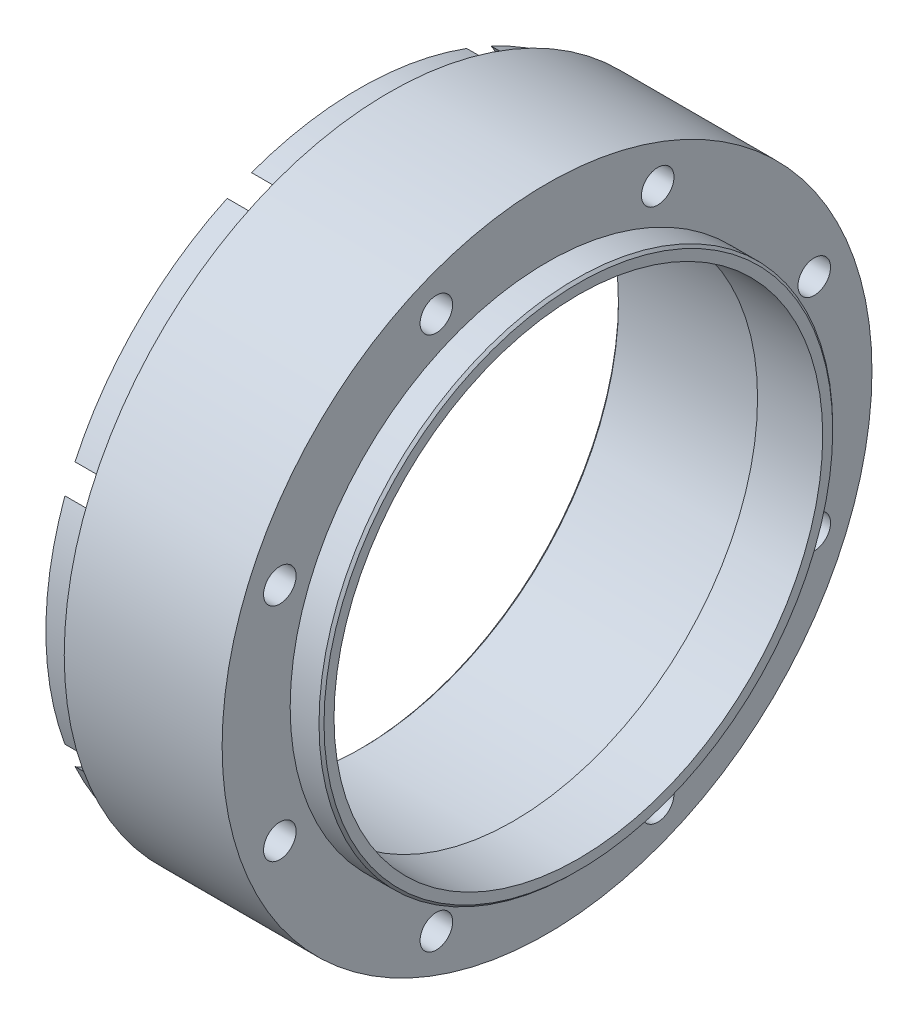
SolidWorks part; units mm, degrees
ref_plane "Front Plane" through (0, 0, 0) normal (0, 0, 1) x (1, 0, 0)
ref_plane "Top Plane" through (0, 0, 0) normal (0, 1, 0) x (1, 0, 0)
ref_plane "Right Plane" through (0, 0, 0) normal (1, 0, 0) x (0, 0, -1)
sketch "Sketch1" plane through (0, 0, 0) normal (1, 0, 0) x (0, 0, -1)
  circle A0 centre (0, 0) radius 65.8622
  dimension "D1" = 131.7244
extrude "Boss-Extrude1" add sketch "Sketch1" along normal blind 44.45
sketch "Sketch2" plane through (44.45, 0, 0) normal (1, 0, 0) x (0, 0, -1)
  circle A0 centre (0, 0) radius 49.53
  dimension "D1" = 99.06
extrude "Cut-Extrude1" cut sketch "Sketch2" against normal blind 152.4
sketch "Sketch7" plane through (0, 0, 0) normal (-1, 0, 0) x (0, 0, 1)
  circle A0 centre (0, 0) radius 63.4873
  dimension "D1" = 126.9746
extrude "Cut-Extrude4" cut sketch "Sketch7" against normal blind 6.096 flip side to cut
sketch "Sketch3" plane through (44.45, 0, 0) normal (1, 0, 0) x (0, 0, -1)
  circle A0 centre (0, 0) radius 52.07
  dimension "D1" = 104.14
extrude "Cut-Extrude2" cut sketch "Sketch3" against normal blind 6.35 flip side to cut
hole_wizard "Tapped Hole for #8-32 Helicoil1" positions "Sketch8" profile "Sketch9" tap size "#8-32" standard "Helicoil® Inch"
sketch "Sketch8" plane through (0, 0, 0) normal (-1, 0, 0) x (0, 0, 1)
  point P0 (0, 60.198)
  dimension "D1" = 60.198
sketch "Sketch9" plane through (0, 60.198, 0) normal (0, 1, 0) x (0, 0, 1)
  line L0 (0, 0) -> (0, 16.8396)
  line L1 (0, 16.8396) -> (2.1971, 15.5194)
  line L2 (2.1971, 15.5194) -> (2.1971, 0)
  line L5 (2.1971, 0) -> (0, 0)
  line L10 (0, 16.8396) -> (-2.1971, 15.5194) construction
  line L11 (0, -6.35) -> (0, 107.95) construction
  dimension "Tap Drill Dia." = 4.3942
  dimension "Tap Drill Depth" = 15.5194
  dimension "Drill Angle" = 118
pattern_circular "CirPattern2" count 8 over 360 about axis through (0, 0, 0) along (1, 0, 0) of "Tapped Hole for #8-32 Helicoil1"
hole_wizard "CBORE for M6 SHCS1" positions "Sketch10" profile "Sketch11" counterbore size "M6" standard "ANSI Metric"
sketch "Sketch10" plane through (0, 0, 0) normal (-1, 0, 0) x (0, 0, 1)
  line L0 (0, 0) -> (22.4348, 54.1624)
  line L2 (0, 0) -> (0, 60.198)
  point P0 (22.4348, 54.1624)
  dimension "D1" = 58.625
  dimension "D2" = 22.5
sketch "Sketch11" plane through (0, 54.1624, 22.4348) normal (0, 1, 0) x (0, 0, 1)
  line L0 (0, 0) -> (0, 44.45)
  line L1 (0, 44.45) -> (3.3, 44.45)
  line L3 (3.3, 44.45) -> (3.3, 31.4)
  line L4 (3.3, 31.4) -> (5.5, 31.4)
  line L5 (5.5, 31.4) -> (5.5, 0)
  line L7 (5.5, 0) -> (0, 0)
  line L11 (0, -6.35) -> (0, 107.95) construction
  dimension "Thru Hole Dia." = 6.6
  dimension "Thru Hole Depth" = 44.45
  dimension "C'Bore Dia." = 11
  dimension "C'Bore Depth" = 31.4
pattern_circular "CirPattern3" count 8 over 360 about axis through (0, 0, 0) along (1, 0, 0) of "CBORE for M6 SHCS1"
sketch "Sketch12" plane through (0, 0, 0) normal (-1, 0, 0) x (0, 0, 1)
  circle A0 centre (0, 0) radius 52.07
extrude "Cut-Extrude5" cut sketch "Sketch12" against normal blind 31.242
chamfer "Chamfer1" distance 0.508 angle 45 1 edges at (44.45, 0, -52.07)
chamfer "Chamfer2" distance 0.508 angle 45 1 edges at (0, 0, 52.07)
